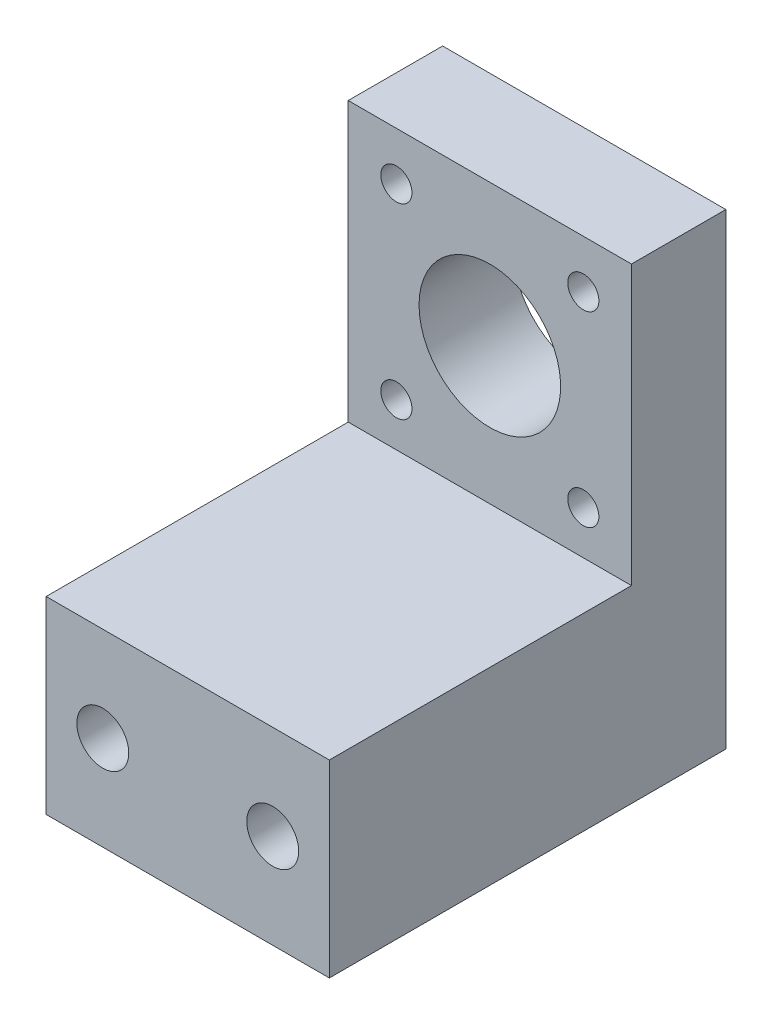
SolidWorks part; units mm, degrees
ref_plane "前视基准面" through (0, 0, 0) normal (0, 0, 1) x (1, 0, 0)
ref_plane "上视基准面" through (0, 0, 0) normal (0, 1, 0) x (1, 0, 0)
ref_plane "右视基准面" through (0, 0, 0) normal (1, 0, 0) x (0, 0, -1)
sketch "草图1" plane through (0, 0, 0) normal (0, 0, 1) x (1, 0, 0)
  line L0 (0, 0) -> (0, 49.5)
  line L1 (30, 0) -> (30, 49.5)
  line L2 (0, 0) -> (30, 0)
  line L3 (0, 49.5) -> (30, 49.5)
  circle A0 centre (15, 34.5) radius 7.5
  circle A1 centre (24, 10) radius 2.75
  circle A2 centre (6, 10) radius 2.75
extrude "凸台-拉伸1" add sketch "草图1" along normal blind 42
sketch "草图2" plane through (30, 0, 0) normal (1, 0, 0) x (0, 0, -1)
  line L0 (-42, 0) -> (-42, 20)
  line L1 (0, 0) -> (0, 49.5)
  line L2 (-10, 20) -> (-10, 49.5)
  line L3 (-10, 49.5) -> (0, 49.5)
  line L4 (-42, 20) -> (-10, 20)
  line L5 (-42, 0) -> (0, 0)
extrude "切除-拉伸1" cut sketch "草图2" against normal blind 42 flip side to cut
sketch "草图3" plane through (0, 0, 10) normal (0, 0, 1) x (1, 0, 0)
  circle A0 centre (5.1, 24.6) radius 1.65
  circle A1 centre (24.9, 44.4) radius 1.65
  circle A2 centre (24.9, 24.6) radius 1.65
  circle A3 centre (5.1, 44.4) radius 1.65
extrude "切除-拉伸2" cut sketch "草图3" against normal blind 42
sketch "草图4" plane through (0, 0, 42) normal (0, 0, 1) x (1, 0, 0)
  circle A0 centre (24, 10) radius 4.75 construction
  circle A1 centre (6, 10) radius 4.75 construction
sketch "草图5" plane through (0, 0, 0) normal (0, 0, -1) x (-1, 0, 0)
  circle A0 centre (-24, 10) radius 4.75
  circle A1 centre (-6, 10) radius 4.75
extrude "切除-拉伸3" cut sketch "草图5" against normal blind 5.5
